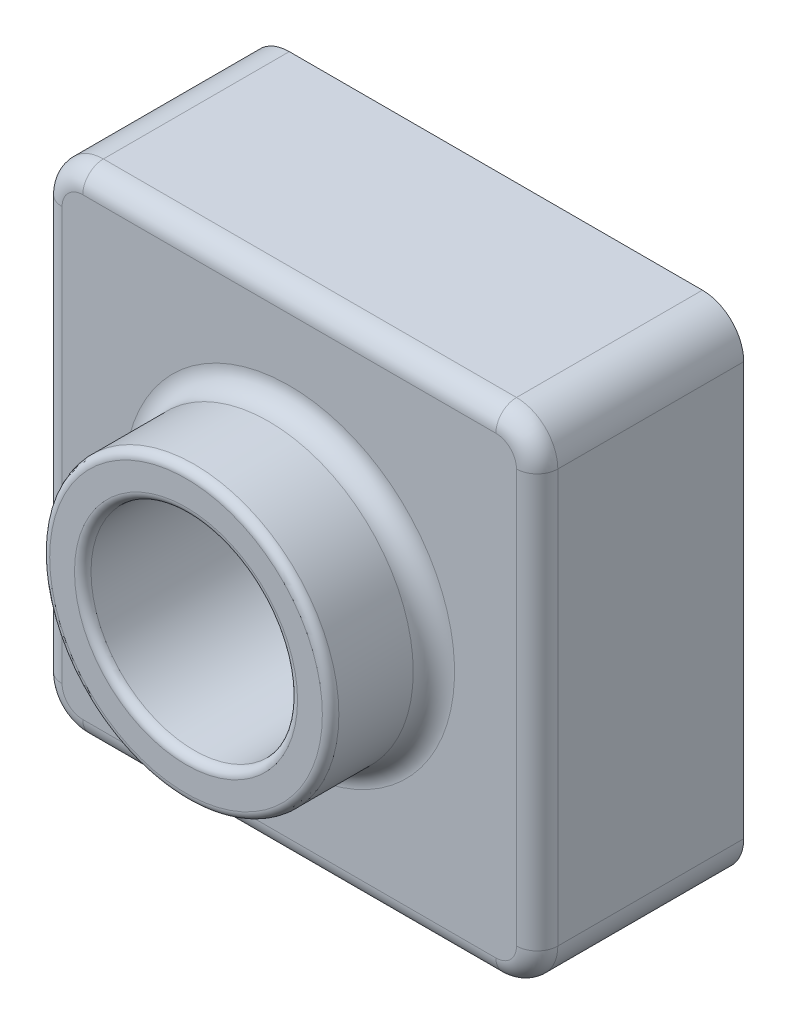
SolidWorks part; units mm, degrees
ref_plane "Plane1" through (0, 0, 0) normal (0, 0, 1) x (1, 0, 0)
ref_plane "Plane2" through (0, 0, 0) normal (0, 1, 0) x (1, 0, 0)
ref_plane "Plane3" through (0, 0, 0) normal (1, 0, 0) x (0, 0, -1)
sketch "Sketch1" plane through (0, 0, 0) normal (0, 0, 1) x (1, 0, 0)
  line L1 (0, 0) -> (120, 0)
  line L2 (0, 0) -> (0, 120)
  line L3 (0, 120) -> (120, 120)
  line L4 (120, 0) -> (120, 120)
  dimension "box_width" = 120
  dimension "box_height" = 120
extrude "Box" add sketch "Sketch1" against normal blind 50
sketch "Sketch2" plane through (0, 0, 0) normal (0, 0, 1) x (1, 0, 0)
  line L0 (120, 120) -> (0, 120) construction
  line L1 (120, 0) -> (120, 120) construction
  circle A0 centre (60, 60) radius 35
  dimension "knob_dia" = 70
  dimension "D1" = 60
  dimension "D2" = 60
extrude "Knob" add sketch "Sketch2" along normal blind 25
sketch "Sketch3" plane through (0, 0, 25) normal (0, 0, 1) x (1, 0, 0)
  circle A0 centre (60, 60) radius 25
  circle A1 centre (60, 60) radius 35 construction
  dimension "hole_dia" = 50
extrude "Hole_in_knob" cut sketch "Sketch3" against normal through all
fillet "Outside_corners" radius 10 4 edges at (0, 120, -25) (120, 120, -25) (120, 0, -25) (0, 0, -25)
fillet "Fillet2" radius 5 9 edges at (25, 60, 0) (120, 60, 0) (0, 60, 0) (60, 0, 0) (60, 120, 0) (2.9289, 2.9289, 0) (117.0711, 2.9289, 0) (2.9289, 117.0711, 0) (117.0711, 117.0711, 0)
fillet "Fillet3" radius 2 2 edges at (95, 60, 25) (85, 60, 25)
shell "Shell1" thickness 4
